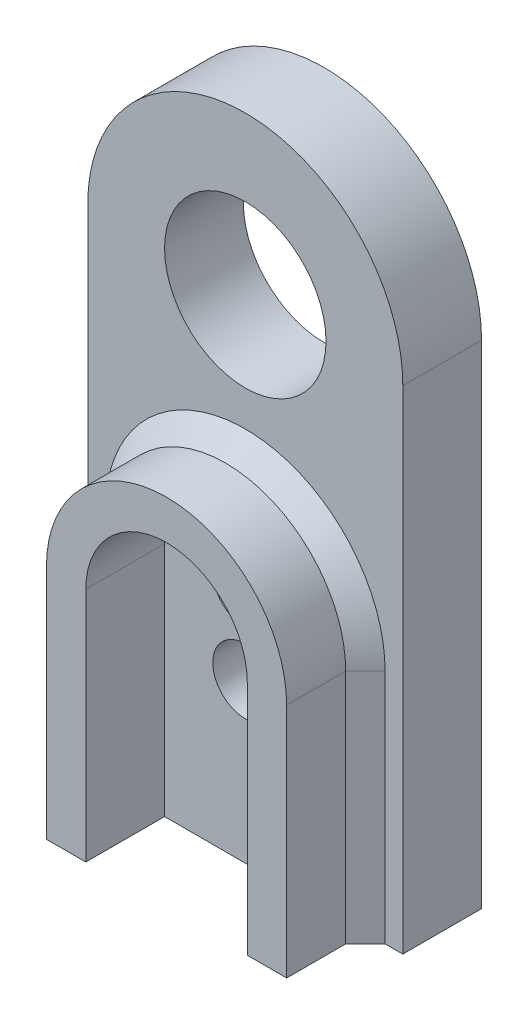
SolidWorks part; units mm, degrees
ref_plane "Спереди" through (0, 0, 0) normal (0, 0, 1) x (1, 0, 0)
ref_plane "Сверху" through (0, 0, 0) normal (0, 1, 0) x (1, 0, 0)
ref_plane "Справа" through (0, 0, 0) normal (1, 0, 0) x (0, 0, -1)
other "Configuration Table"
sketch "Эскиз1" plane through (0, 0, 0) normal (0, 0, 1) x (1, 0, 0)
  line L0 (0, 0) -> (0, -30) construction
  line L1 (8, 0) -> (8, -30)
  line L2 (-8, 0) -> (-8, -30)
  circle A0 centre (0, 0) radius 4.1
  arc A1 (8, 0) -> (-8, 0) centre (0, 0) ccw
  arc A2 (-8, -30) -> (8, -30) centre (0, -30) ccw
  circle A3 centre (0, -30) radius 4.1
  point P3 (0, -15)
  dimension "D1" = 8.2
  dimension "D2" = 8
  dimension "D3" = 30
extrude "Бобышка-Вытянуть1" add sketch "Эскиз1" along normal blind 4
sketch "Эскиз2" plane through (0, 0, 4) normal (0, 0, 1) x (1, 0, 0)
  line L2 (-8, 0) -> (-8, -30)
  line L3 (8, -30) -> (8, 0)
  line L4 (-8, 0) -> (-8, -30)
  line L5 (8, -30) -> (8, 0)
  arc A2 (8, 0) -> (-8, 0) centre (0, 0) ccw
  arc A3 (-8, -30) -> (8, -30) centre (0, -30) ccw
  arc A4 (8, 0) -> (-8, 0) centre (0, 0) ccw
  arc A5 (-8, -30) -> (8, -30) centre (0, -30) ccw
  circle A11 centre (0, 0) radius 3.3
  circle A12 centre (0, 0) radius 3.3
  circle A14 centre (0, -30) radius 3.3
  circle A15 centre (0, -30) radius 3.3
  dimension "D1" = 0
  dimension "D2" = 0.8
  dimension "D3" = 0.8
sketch "Эскиз3" plane through (0, 0, 0) normal (0, 0, -1) x (-1, 0, 0)
  line L1 (-8, -25) -> (10.8407, -25)
  line L2 (-8, -25) -> (-8, -50.3057)
  line L3 (-8, -50.3057) -> (10.8407, -50.3057)
  line L4 (10.8407, -25) -> (10.8407, -50.3057)
  arc A0 (8, 0) -> (-8, 0) centre (0, 0) ccw construction
  point P7 (0, 8)
  dimension "D1" = 33
extrude "Вырез-Вытянуть1" cut sketch "Эскиз3" against normal blind 10
sketch "Эскиз4" plane through (0, 0, 4) normal (0, 0, -1) x (-1, 0, 0)
  line L0 (0, -25) -> (0, -13) construction
  line L1 (8, -25) -> (-8, -25) construction
  line L2 (6.1, -25) -> (6.1, -13)
  line L3 (4.1, -25) -> (-4.1, -25) construction
  line L4 (4.1, -25) -> (4.1, -13)
  line L5 (4.1, -13) -> (-4.1, -13) construction
  line L6 (-4.1, -25) -> (-4.1, -13)
  line L7 (4.1, -25) -> (-4.1, -13) construction
  line L8 (4.1, -13) -> (-4.1, -25) construction
  line L9 (-6.1, -25) -> (-6.1, -13)
  line L10 (6.1, -25) -> (4.1, -25)
  line L11 (-4.1, -25) -> (-6.1, -25)
  arc A0 (-4.1, -13) -> (4.1, -13) centre (0, -13) cw
  arc A1 (-6.1, -13) -> (6.1, -13) centre (0, -13) cw
  point P5 (0, -19)
  dimension "D1" = 12
  dimension "D2" = 8.2
  dimension "D3" = 2
extrude "Бобышка-Вытянуть3" add sketch "Эскиз4" against normal blind 4
sketch "Эскиз5" plane through (0, 0, 5) normal (0, 0, 1) x (1, 0, 0)
  line L0 (-4, -13) -> (4, -13) construction
  line L1 (0, -13) -> (0, -17) construction
  circle A0 centre (0, -13) radius 1.65
  circle A1 centre (0, -17) radius 1.65
  point P9 (-4, -13)
  point P11 (4, -13)
  point P12 (4, -13)
  dimension "D2" = 3.3
  dimension "D1" = 4
extrude "Вырез-Вытянуть2" cut sketch "Эскиз5" against normal through all
chamfer "Фаска1" distance 1 angle 45 3 edges at (-6.1, -19, 4) (6.1, -19, 4) (0, -6.9, 4)
